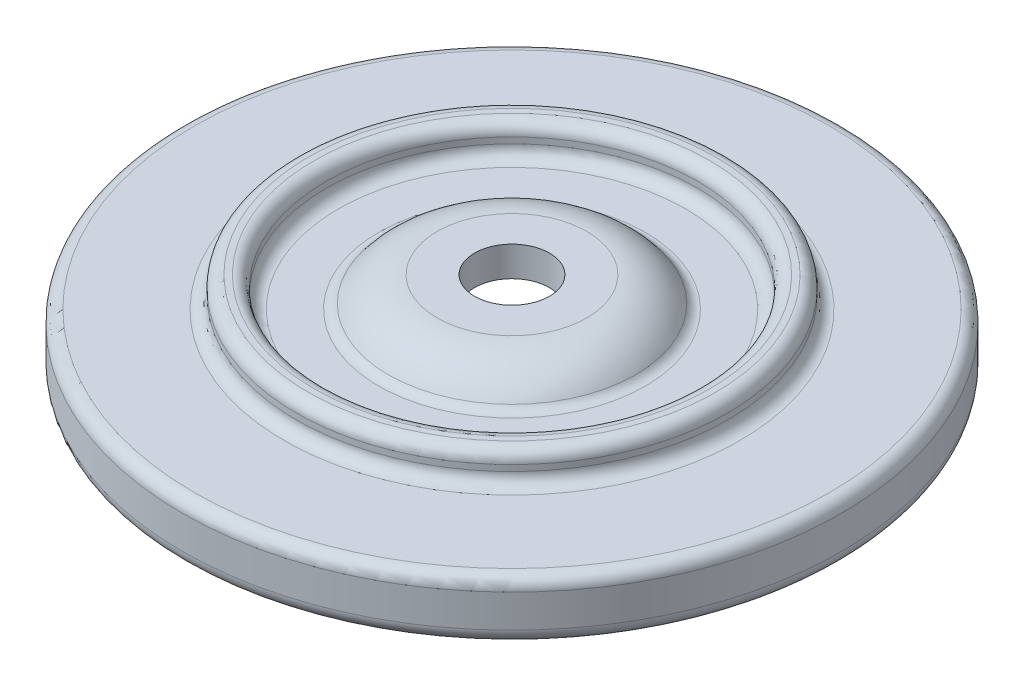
SolidWorks part; units mm, degrees
ref_plane "Plane1" through (0, 0, 0) normal (0, 0, 1) x (1, 0, 0)
ref_plane "Plane2" through (0, 0, 0) normal (0, 1, 0) x (1, 0, 0)
ref_plane "Plane3" through (0, 0, 0) normal (1, 0, 0) x (0, 0, -1)
sketch "Sketch1" plane through (0, 0, 0) normal (0, 0, 1) x (1, 0, 0)
  line L0 (0, 0) -> (0, 2.253) construction
  line L1 (0, 0) -> (9.144, 0)
  line L2 (9.144, 0) -> (9.144, -1.27)
  line L3 (9.144, -1.27) -> (13.97, -1.27)
  line L4 (13.97, -1.27) -> (13.97, -3.81)
  line L5 (13.97, -3.81) -> (0, -3.81)
  line L6 (0, -3.81) -> (0, 0)
  dimension "D1" = 9.144
  dimension "D2" = 13.97
  dimension "D3" = 2.54
  dimension "D4" = 1.27
revolve "Outside body" add sketch "Sketch1" angle 360 about L0
sketch "Sketch2" plane through (0, 0, 0) normal (0, 0, 1) x (1, 0, 0)
  line L0 (0, 0) -> (0, -5.1112) construction
  line L1 (7.874, 0) -> (7.874, -1.27)
  line L2 (9.144, 0) -> (-9.144, 0) construction
  line L3 (13.97, -1.27) -> (-13.97, -1.27) construction
  line L4 (7.874, -1.27) -> (5.3747, -1.27)
  line L5 (7.874, 0) -> (3.175, 0)
  arc A0 (5.3747, -1.27) -> (3.175, 0) centre (3.175, -2.54) ccw
  dimension "D1" = 2.54
  dimension "D2" = 7.874
  dimension "D3" = 3.175
revolve "Top" cut sketch "Sketch2" angle 360 about L0
sketch "Sketch3" plane through (0, 0, 0) normal (0, 0, 1) x (1, 0, 0)
  line L0 (0, 0) -> (0, -5.4043) construction
  line L1 (12.7, -3.81) -> (0, -3.81)
  line L2 (12.7, -3.81) -> (12.7, -3.048)
  line L3 (12.7, -3.048) -> (4.339, -3.048)
  line L4 (0, -3.81) -> (0, -1.27)
  line L5 (0, -1.27) -> (3.175, -1.27)
  line L6 (3.175, 0) -> (-3.175, 0) construction
  line L7 (7.874, -1.27) -> (5.3747, -1.27) construction
  line L8 (13.97, -3.81) -> (-13.97, -3.81) construction
  arc A0 (3.175, -1.27) -> (4.339, -3.048) centre (3.175, -2.54) cw
  arc A1 (5.3747, -1.27) -> (3.175, 0) centre (3.175, -2.54) ccw construction
  dimension "D1" = 1.27
  dimension "D2" = 1.778
  dimension "D3" = 12.7
revolve "Bottom" cut sketch "Sketch3" angle 360 about L0
fillet "Fillet1" radius 0.635 1 edges at (0, -3.81, -13.97)
fillet "Fillet4" radius 0.508 1 edges at (0, -3.81, 12.7)
fillet "Fillet5" radius 0.508 2 edges at (0, -3.048, 12.7) (0, -3.302, 12.7)
fillet "Fillet6" radius 1.27 1 edges at (0, -3.048, 4.339)
fillet "Fillet7" radius 0.508 6 edges at (0, 0, 7.874) (0, -1.27, 5.3747) (0, -1.27, 7.874) (0, -1.27, -13.97) (0, -1.27, -9.144) (0, 0, -9.144)
sketch "Sketch4" plane through (0, 0, 0) normal (0, 1, 0) x (-1, 0, 0)
  circle A0 centre (0, 0) radius 1.5875
  dimension "D1" = 3.175
extrude "Mounting Hole" cut sketch "Sketch4" against normal through all
